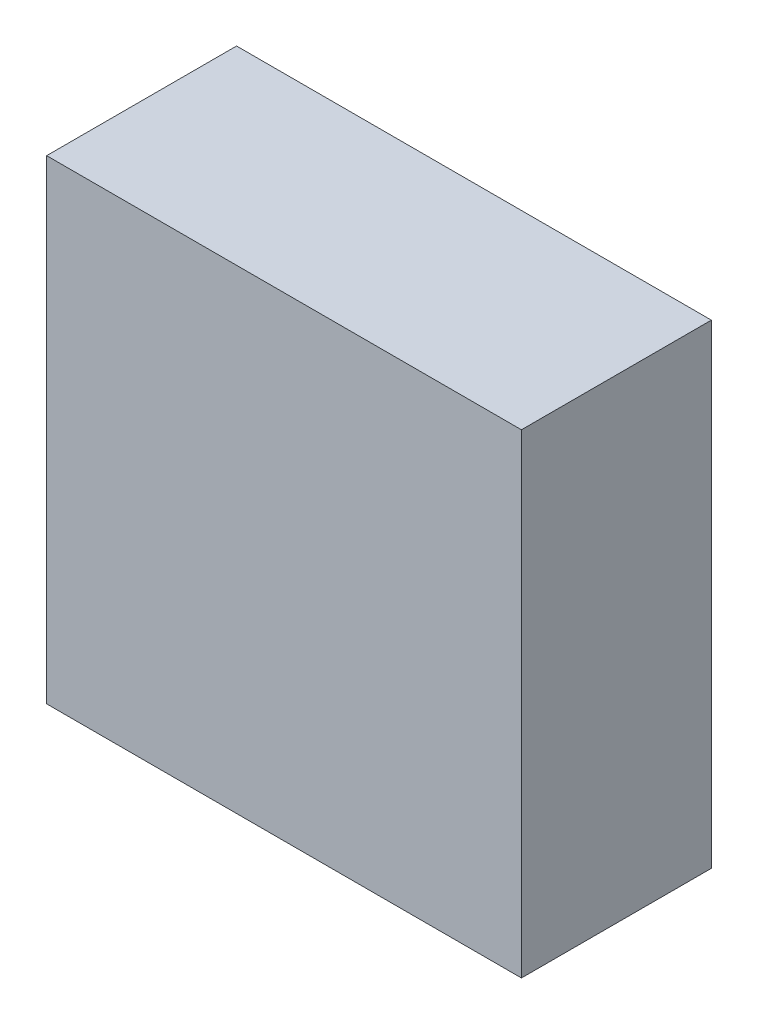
SolidWorks part; units mm, degrees
ref_plane "Vorne" through (0, 0, 0) normal (0, 0, 1) x (1, 0, 0)
ref_plane "Oben" through (0, 0, 0) normal (0, 1, 0) x (1, 0, 0)
ref_plane "Rechts" through (0, 0, 0) normal (1, 0, 0) x (0, 0, -1)
sketch "Skizze1" plane through (0, 0, 0) normal (0, 0, 1) x (1, 0, 0)
  line L1 (0, 0) -> (25, 0)
  line L2 (0, 0) -> (0, 25)
  line L3 (0, 25) -> (25, 25)
  line L4 (25, 0) -> (25, 25)
  dimension "D1" = 25
extrude "Linear austragen1" add sketch "Skizze1" along normal blind 10
